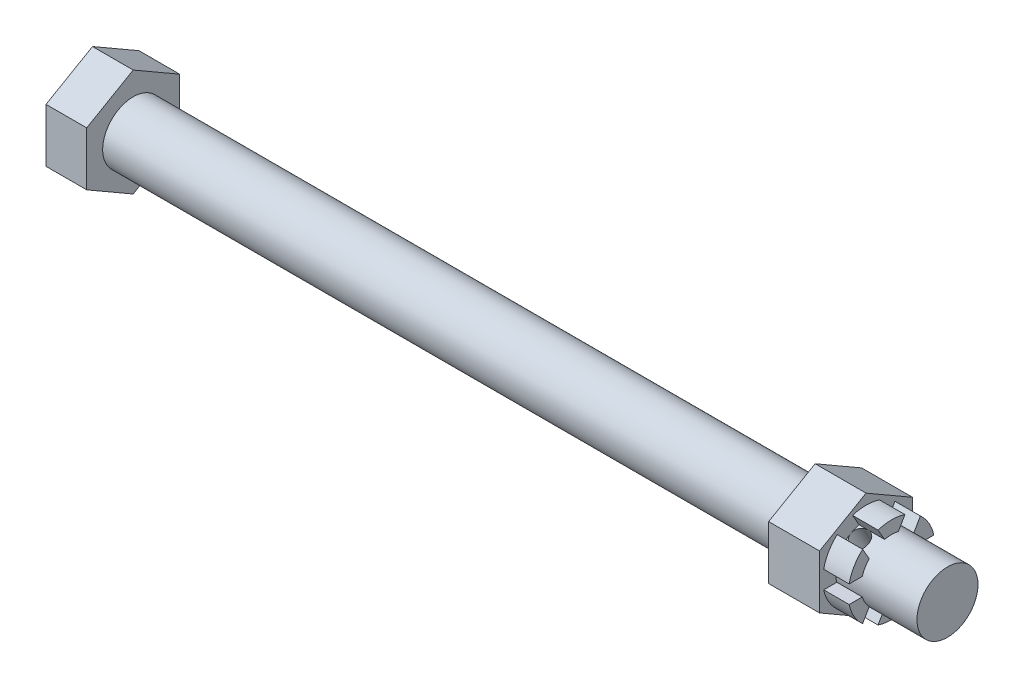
SolidWorks part; units mm, degrees
ref_plane "Face" through (0, 0, 0) normal (0, 0, 1) x (1, 0, 0)
ref_plane "Dessus" through (0, 0, 0) normal (0, 1, 0) x (1, 0, 0)
ref_plane "Droite" through (0, 0, 0) normal (1, 0, 0) x (0, 0, -1)
sketch "Esquisse1" plane through (0, 0, 0) normal (0, 0, 1) x (1, 0, 0)
  line L0 (-92.6229, 6) -> (41.3771, 6)
  line L1 (67.3771, 6) -> (67.3771, 0)
  line L2 (-92.6229, 0) -> (67.3771, 0)
  line L3 (-92.6229, 0) -> (-92.6229, 6)
  line L4 (41.3771, 10.55) -> (51.3771, 10.55)
  line L5 (56.3771, 8.5) -> (56.3771, 6)
  line L6 (56.3771, 6) -> (67.3771, 6)
  line L7 (41.3771, 6) -> (41.3771, 10.55)
  line L8 (51.3771, 10.55) -> (51.3771, 8.5)
  line L9 (51.3771, 8.5) -> (56.3771, 8.5)
  line L11 (85.1881, 0) -> (-103.3588, 0) construction
  dimension "D1" = 160
  dimension "D2" = 6
  dimension "D7" = 134
  dimension "D8" = 10
revolve "Base-Révolution" add sketch "Esquisse1" angle 360 about L11
sketch "Esquisse2" plane through (-92.6229, 0, 0) normal (-1, 0, 0) x (0, 0, 1)
  line L1 (0, 10.55) -> (-9.1366, 5.275)
  line L2 (-9.1366, 5.275) -> (-9.1366, -5.275)
  line L3 (-9.1366, -5.275) -> (0, -10.55)
  line L4 (0, -10.55) -> (9.1366, -5.275)
  line L5 (9.1366, -5.275) -> (9.1366, 5.275)
  line L6 (9.1366, 5.275) -> (0, 10.55)
  circle A0 centre (0, 0) radius 9.1366 construction
  circle A1 centre (0, 0) radius 10.55 construction
extrude "Boss.-Extru.1" add sketch "Esquisse2" along normal blind 8
sketch "Esquisse3" plane through (51.3771, 0, 0) normal (1, 0, 0) x (0, 0, -1)
  line L1 (0, 10.55) -> (-9.1366, 5.275)
  line L2 (-9.1366, 5.275) -> (-9.1366, -5.275)
  line L3 (-9.1366, -5.275) -> (0, -10.55)
  line L4 (0, -10.55) -> (9.1366, -5.275)
  line L5 (9.1366, -5.275) -> (9.1366, 5.275)
  line L6 (9.1366, 5.275) -> (0, 10.55)
  circle A0 centre (0, 0) radius 9.1366 construction
  dimension "D1" = 21.1
extrude "Enlèv. mat.-Extru.2" cut sketch "Esquisse3" against normal through all flip side to cut
sketch "Esquisse4" plane through (56.3771, 0, 0) normal (1, 0, 0) x (0, 0, -1)
  line L0 (-2.6434, 8.0785) -> (-1.354, 5.8452)
  line L1 (4.3851, -4.0952) -> (5.6745, -6.3285)
  line L2 (-4.3851, 4.0952) -> (-5.6745, 6.3285)
  line L3 (-8.3179, 1.75) -> (-5.7391, 1.75)
  line L4 (0, 10.55) -> (-9.1366, 5.275) construction
  line L5 (2.6434, -8.0785) -> (1.354, -5.8452)
  line L6 (-5.7391, -1.75) -> (-8.3179, -1.75)
  line L7 (0, -10.55) -> (9.1366, -5.275) construction
  line L8 (8.3179, -1.75) -> (5.7391, -1.75)
  line L9 (2.6434, 8.0785) -> (1.354, 5.8452)
  line L10 (9.1366, -5.275) -> (9.1366, 5.275) construction
  line L11 (5.7391, 1.75) -> (8.3179, 1.75)
  line L13 (-2.6434, -8.0785) -> (-1.354, -5.8452)
  line L14 (4.3851, 4.0952) -> (5.6745, 6.3285)
  line L15 (9.1366, 5.275) -> (0, 10.55) construction
  line L16 (-4.3851, -4.0952) -> (-5.6745, -6.3285)
  arc A0 (4.3851, 4.0952) -> (1.354, 5.8452) centre (0, 0) ccw
  circle A1 centre (0, 0) radius 6 construction
  arc A2 (5.6745, 6.3285) -> (2.6434, 8.0785) centre (0, 0) ccw
  circle A3 centre (0, 0) radius 8.5 construction
  arc A4 (5.7391, -1.75) -> (5.7391, 1.75) centre (0, 0) ccw
  arc A5 (8.3179, -1.75) -> (8.3179, 1.75) centre (0, 0) ccw
  arc A6 (1.354, -5.8452) -> (4.3851, -4.0952) centre (0, 0) ccw
  arc A7 (2.6434, -8.0785) -> (5.6745, -6.3285) centre (0, 0) ccw
  arc A8 (-5.6745, -6.3285) -> (-2.6434, -8.0785) centre (0, 0) ccw
  arc A9 (-4.3851, -4.0952) -> (-1.354, -5.8452) centre (0, 0) ccw
  arc A10 (-5.7391, 1.75) -> (-5.7391, -1.75) centre (0, 0) ccw
  arc A11 (-8.3179, 1.75) -> (-8.3179, -1.75) centre (0, 0) ccw
  arc A12 (-2.6434, 8.0785) -> (-5.6745, 6.3285) centre (0, 0) ccw
  arc A13 (-1.354, 5.8452) -> (-4.3851, 4.0952) centre (0, 0) ccw
  dimension "D1" = 3.5
  dimension "D2" = 3.525
  dimension "D3" = 3.5
  dimension "D4" = 3.525
  dimension "D5" = 3.5
  dimension "D6" = 3.525
  dimension "D7" = 3.5
  dimension "D8" = 3.525
extrude "Enlèv. mat.-Extru.3" cut sketch "Esquisse4" against normal blind 5
sketch "Esquisse5" plane through (0, -7.9125, -4.5683) normal (0, -0.866, -0.5) x (1, 0, 0)
  line L0 (51.3771, 0) -> (56.3771, 0) construction
  line L3 (51.3771, 5.275) -> (51.3771, -5.275) construction
  circle A0 centre (53.1271, 0) radius 1.75
  dimension "D1" = 3.5
  dimension "D2" = 1.75
extrude "Enlèv. mat.-Extru.4" cut sketch "Esquisse5" against normal through all
